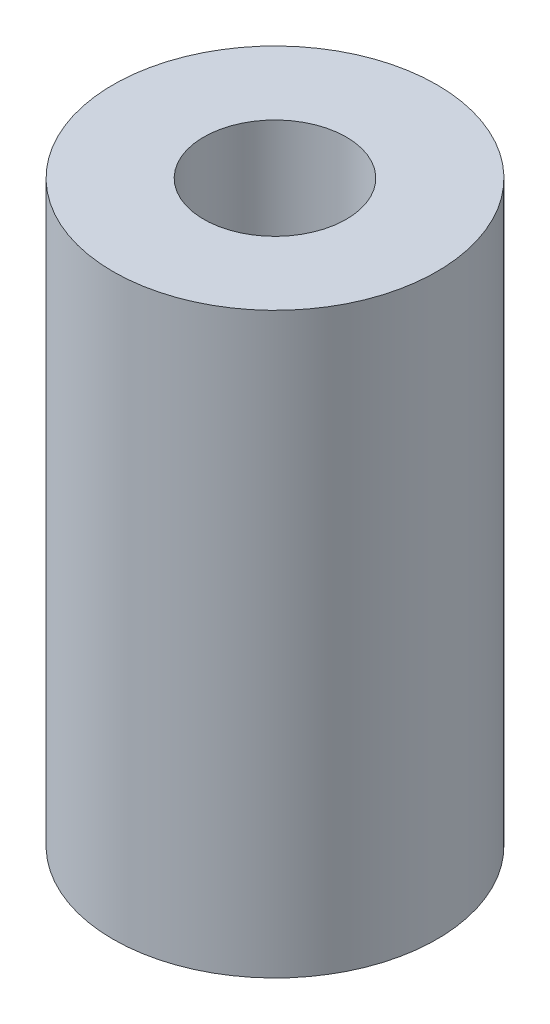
SolidWorks part; units mm, degrees
ref_plane "Front" through (0, 0, 0) normal (0, 0, 1) x (1, 0, 0)
ref_plane "Top" through (0, 0, 0) normal (0, 1, 0) x (1, 0, 0)
ref_plane "Right" through (0, 0, 0) normal (1, 0, 0) x (0, 0, -1)
sketch "Sketch1" plane through (0, 0, 0) normal (0, 1, 0) x (1, 0, 0)
  circle A0 centre (0, 0) radius 5.334
  circle A1 centre (0, 0) radius 2.3495
  dimension "D1" = 10.668
  dimension "D2" = 4.699
extrude "MagBody" add sketch "Sketch1" along normal blind 19.05
